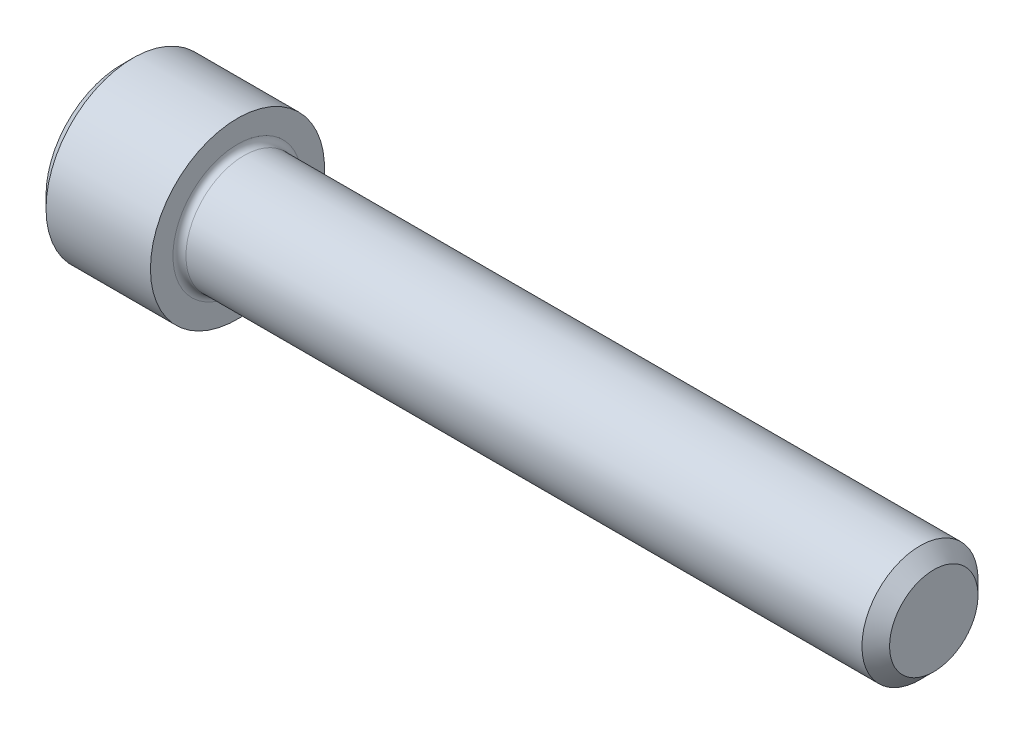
SolidWorks part; units mm, degrees
ref_plane "Plane1" through (0, 0, 0) normal (0, 0, 1) x (1, 0, 0)
ref_plane "Plane2" through (0, 0, 0) normal (0, 1, 0) x (1, 0, 0)
ref_plane "Plane3" through (0, 0, 0) normal (1, 0, 0) x (0, 0, -1)
sketch "BodySke" plane through (0, 0, 0) normal (0, 0, 1) x (1, 0, 0)
  line L0 (0, 0) -> (0, 4.1275)
  line L1 (0.635, 4.7625) -> (6.35, 4.7625)
  line L2 (6.35, 4.7625) -> (6.35, 3.175)
  line L3 (6.35, 3.175) -> (43.6943, 3.175)
  line L4 (44.45, 2.4194) -> (44.45, 0)
  line L5 (44.45, 0) -> (0, 0)
  line L6 (-31.75, 0) -> (127, 0) construction
  line L7 (0, 4.1275) -> (0.635, 4.7625)
  line L8 (44.45, 2.4194) -> (43.6943, 3.175)
  line L9 (0, -4.1275) -> (0.635, -4.7625) construction
  line L10 (44.45, -2.4194) -> (43.6943, -3.175) construction
  line L11 (7.62, 9.525) -> (7.62, 3.175) construction
  line L12 (19.05, 9.525) -> (19.05, 3.175) construction
  line L13 (6.35, 9.525) -> (6.35, 3.175) construction
  dimension "Diameter" = 6.35
  dimension "Head_ht" = 6.35
  dimension "Length" = 38.1
  dimension "Body_ch_ang" = 45
  dimension "Head_dia" = 9.525
  dimension "Head_ch_ang" = 45
  dimension "Head_side_ht" = 5.715
  dimension "Minor_dia" = 4.8387
  dimension "Advance" = 1.27
  dimension "Thread_nom" = 25.4
  dimension "Thread_length" = 38.1
revolve "Base-Revolve" add sketch "BodySke"
fillet "Fillet1" radius 0.3556 1 edges at (6.35, 0, 3.175)
sketch "Sketch2" plane through (0, 0, 0) normal (0, 0, 1) x (1, 0, 0)
  line L0 (0, 2.3812) -> (3.048, 2.3812)
  line L1 (3.048, 2.3812) -> (4.4228, 0)
  line L2 (-31.75, 0) -> (127, 0) construction
  line L3 (4.4228, 0) -> (0, 0)
  line L4 (0, 0) -> (0, 2.3812)
  line L5 (0, 4.1275) -> (0, -4.1275) construction
  line L6 (0, 0) -> (47.625, 0) construction
  line L7 (6.35, -4.7625) -> (6.35, 4.7625) construction
  dimension "D1" = 2.3813
  dimension "D2" = 60
  dimension "Wall_thickness" = 3.302
revolve "Hex-PreBroach" cut sketch "Sketch2" angle 360 about L6
sketch "Sketch3" plane through (0, 0, 0) normal (-1, 0, 0) x (0, 0.5, 0.866)
  line L0 (1.3748, 2.3813) -> (-1.3748, 2.3813)
  line L1 (-1.3748, 2.3813) -> (-2.7496, 0)
  line L2 (1.3748, 2.3813) -> (2.7496, 0)
  line L3 (1.3748, -2.3812) -> (2.7496, 0)
  line L4 (1.3748, -2.3812) -> (-1.3748, -2.3812)
  line L5 (-1.3748, -2.3812) -> (-2.7496, 0)
  dimension "D1" = 2.3813
  dimension "D2" = 2.3813
  dimension "Hex_size" = 4.7625
extrude "Hex" cut sketch "Sketch3" against normal blind 3.048
sketch "Sketch4" plane through (0, 0, 0) normal (-1, 0, 0) x (0, 0, 1)
  line L0 (0, 0) -> (2.8067, 0)
  line L1 (0, 0) -> (6.1484, 3.5498) construction
  line L2 (0, 0) -> (1.4033, 2.4307)
  line L3 (2.3336, 0.614) -> (2.6851, 0.817)
  line L4 (1.6986, 1.7139) -> (2.0501, 1.9169)
  arc A0 (2.3336, 0.614) -> (1.6986, 1.7139) centre (0, 0) ccw
  arc A1 (2.8067, 0) -> (2.6851, 0.817) centre (0, 0) ccw
  arc A2 (1.4033, 2.4307) -> (2.0501, 1.9169) centre (0, 0) cw
  dimension "D1" = 30
  dimension "Spline_n_dim" = 4.826
  dimension "Spline_m_dim" = 5.6134
  dimension "D2" = 60
  dimension "D3" = 0.635
  dimension "Spline_p_dim" = 1.27
extrude "Spline" [suppressed] cut sketch "Sketch4" against normal blind 3.048
pattern_circular "CirPattern1" [suppressed] count 6 every 60
sketch "Sketch5" plane through (0, 0, 0) normal (0, 0, 1) x (1, 0, 0)
  line L0 (-31.75, 0) -> (127, 0) construction
  line L2 (0, 4.1275) -> (0, -4.1275) construction
  circle A0 centre (2.159, 0) radius 0.5905
  dimension "Drilled_hole_dia" = 1.1811
  dimension "Drilled_hole_loc" = 2.159
extrude "Hole" [suppressed] cut sketch "Sketch5" against normal through all and the other way through all
pattern_circular "Drilled-4" [suppressed] count 2 every 60
pattern_circular "Drilled-6" [suppressed] count 3 every 60
sketch "ThdSchSke" plane through (0, 0, 0) normal (0, 0, 1) x (1, 0, 0)
  line L0 (19.05, -2.4194) -> (18.5209, -3.175)
  line L1 (19.05, -2.4194) -> (19.5791, -3.175)
  line L2 (19.5791, -3.175) -> (19.5791, -3.9688)
  line L3 (-3.175, 0) -> (5.1513, 0) construction
  line L5 (19.5791, -3.9688) -> (18.5209, -3.9688)
  line L6 (18.5209, -3.9688) -> (18.5209, -3.175)
  line L7 (0, 4.1275) -> (0, -4.1275) construction
  dimension "Thread_minor" = 4.8387
  dimension "Diameter" = 6.35
  dimension "Start" = 19.05
  dimension "SideAngle" = 55
  dimension "VeeAngle" = 70
  dimension "Overcut" = 7.9375
revolve "ThreadSchematic" [suppressed] cut sketch "ThdSchSke" angle 360 about L3
pattern_linear "ThdSchPat" [suppressed]
equation "\"D2@Sketch3\" = \"Hex_size@Sketch3\" / 2"
equation "\"D1@Sketch3\" = \"Hex_size@Sketch3\" / 2"
equation "\"D1@Sketch2\" = \"Hex_size@Sketch3\" / 2"
equation "\"D3@Sketch4\" = \"Spline_p_dim@Sketch4\" / 2"
equation "\"Thread_minor@ThreadCosmetic\"  =  \"Minor_dia@BodySke\""
equation "\"D2@CirPattern1\" = 360 / \"Num_teeth@CirPattern1\""
equation "\"Wall_thickness@Sketch2\" = \"Head_ht@BodySke\" - \"Key_eng@Hex\""
equation "\"Thread_length@ThreadCosmetic\" = ((sgn( (\"Length@BodySke\" - \"Advance@BodySke\" ) - \"Thread_nom@BodySke\" )-1)*( (\"Length@BodySke\" - \"Advance@BodySke\" ) - \"Thread_nom@BodySke\" ))/-2+ \"Thread_nom@BodySke\""
equation "\"Thread_minor@ThdSchSke\" = \"Minor_dia@BodySke\""
equation "\"Diameter@ThdSchSke\" = \"Diameter@BodySke\""
equation "\"Overcut@ThdSchSke\" = \"Diameter@BodySke\" * 1.25"
equation "\"Start@ThdSchSke\" = \"Head_ht@BodySke\" + \"Length@BodySke\" - \"Thread_length@ThreadCosmetic\"  '---Non-countersunk---"
equation "\"Num_threads@ThdSchPat\" = int( \"Thread_length@ThreadCosmetic\" / \"Advance@BodySke\" + 0.999 )  + 1"
equation "\"Advance@ThdSchPat\" = \"Thread_length@ThreadCosmetic\" /  (\"Num_threads@ThdSchPat\" - 1) 'relax it"
equation "\"Num_threads@ThdSchPat\" = \"Num_threads@ThdSchPat\" - sgn( \"Num_threads@ThdSchPat\" - 1) '---chamfered tips only---"
